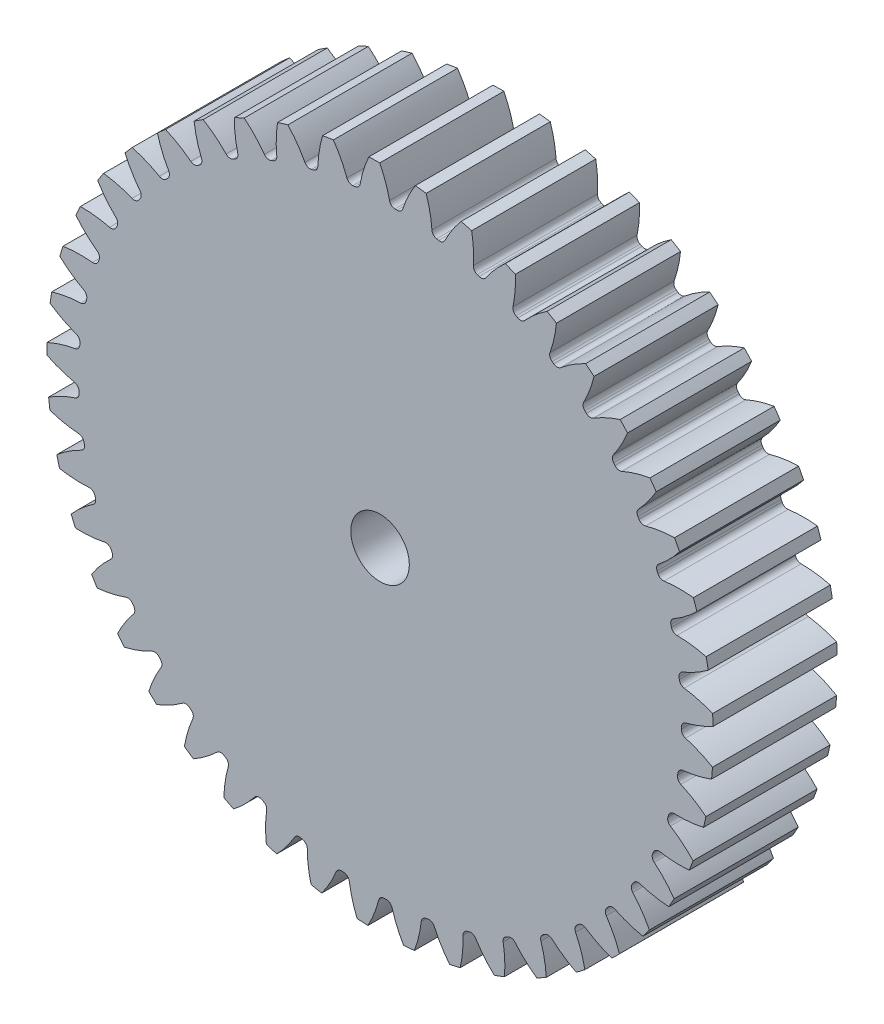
SolidWorks part; units mm, degrees
ref_plane "Front" through (0, 0, 0) normal (0, 0, 1) x (1, 0, 0)
ref_plane "Top" through (0, 0, 0) normal (0, 1, 0) x (1, 0, 0)
ref_plane "Right" through (0, 0, 0) normal (1, 0, 0) x (0, 0, -1)
sketch "Sketch3" plane through (0, 0, 0) normal (0, 0, 1) x (1, 0, 0)
  circle A0 centre (0, 0) radius 238.76
  dimension "od" = 477.52
extrude "gearBody" add sketch "Sketch3" along normal blind 88.9
sketch "Sketch2" plane through (0, 0, 0) normal (0, 0, 1) x (1, 0, 0)
  line L0 (0, 0) -> (198.462, 82.2057) construction
  line L1 (238.3051, -17.0726) -> (0, 0) construction
  line L2 (0, 0) -> (36.3143, 0) construction
  line L3 (228.5667, 3.904) -> (228.2854, -11.9898) construction
  line L5 (228.426, -4.0429) -> (0, 0) construction
  line L7 (0, 0) -> (214.8137, 0) construction
  arc A0 (214.8137, -0.0748) -> (214.6818, -7.5269) centre (0, 0) ccw construction
  arc A1 (238.607, 8.5455) -> (238.1552, -16.9837) centre (0, 0) ccw construction
  arc A2 (228.5667, 3.904) -> (228.2854, -11.9898) centre (0, 0) ccw construction
  arc A3 (215.8518, -4.5601) -> (215.878, -3.0811) centre (0, 0) ccw
  arc A4 (238.3051, -17.0726) -> (218.8324, -8.6184) centre (195.4287, -89.1771) ccw
  arc A5 (238.3051, -17.0726) -> (238.76, 8.629) centre (0, 0) ccw
  arc A6 (238.76, 8.629) -> (219.0003, 0.8692) centre (198.462, 82.2057) cw
  arc A7 (215.878, -3.0811) -> (219.0003, 0.8692) centre (220.0127, -3.1401) cw
  arc A8 (218.8324, -8.6184) -> (215.8518, -4.5601) centre (219.986, -4.6474) cw
  point P6 (238.76, 8.629)
  point P22 (238.3051, -17.0726)
  dimension "baseDia" = 429.6275
  dimension "od" = 477.52
  dimension "pd" = 457.2
  dimension "rd" = 431.8
  dimension "rFillet" = 4.1351
  dimension "pointX" = 238.76
  dimension "pointY" = 8.629
  dimension "CTT" = 15.8937
  dimension "flankCenterAngle" = 22.5
extrude "toothCut" cut sketch "Sketch2" along normal through all
pattern_circular "CirPattern1" count 45 over 360 about axis through (0, 0, 0) along (0, 0, 1) of "toothCut"
sketch "hub1Dia" plane through (0, 0, 0) normal (0, 0, -1) x (-1, 0, 0)
  circle A0 centre (0, 0) radius 12.7
  dimension "hub1Dia" = 25.4
sketch "hub2Dia" plane through (0, 0, 88.9) normal (0, 0, 1) x (1, 0, 0)
  circle A0 centre (0, 0) radius 12.7
  dimension "hub2dia" = 25.4
sketch "boreDia" plane through (0, 0, 0) normal (0, 0, 1) x (1, 0, 0)
  circle A0 centre (0, 0) radius 20.955
  dimension "boreDia" = 41.91
extrude "bore" cut sketch "boreDia" against normal mid plane 25400
